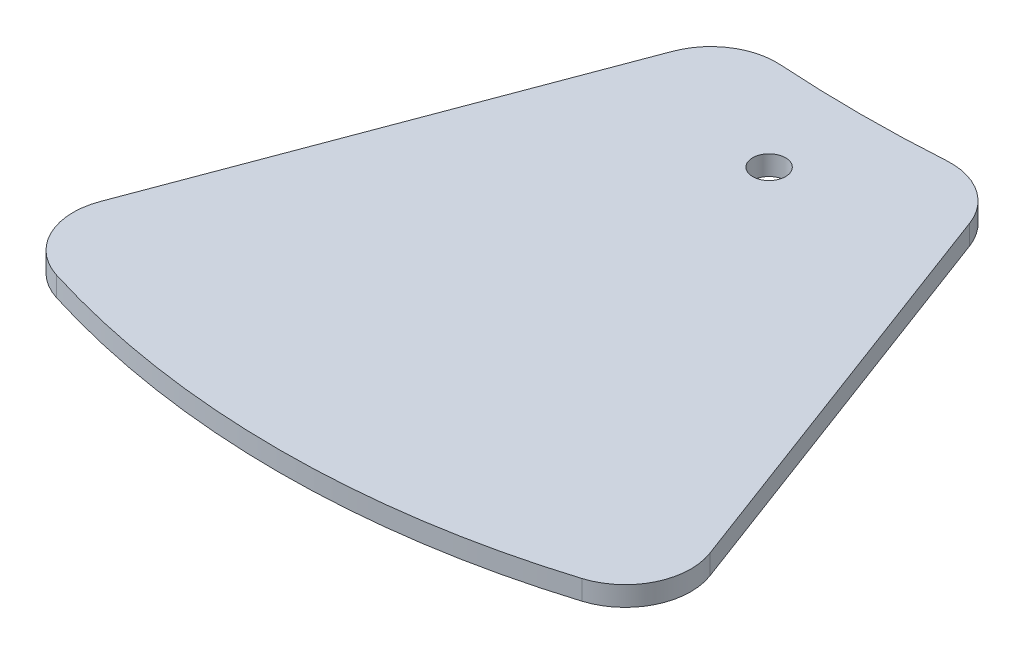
SolidWorks part; units mm, degrees
ref_plane "Front Plane" through (0, 0, 0) normal (0, 0, 1) x (1, 0, 0)
ref_plane "Top Plane" through (0, 0, 0) normal (0, 1, 0) x (1, 0, 0)
ref_plane "Right Plane" through (0, 0, 0) normal (1, 0, 0) x (0, 0, -1)
sketch "Sketch1" plane through (0, 0, 0) normal (0, 1, 0) x (1, 0, 0)
  line L0 (-20, 15) -> (-50, -65)
  line L1 (50, -65) -> (20, 15)
  line L2 (-20, 15) -> (20, 15) construction
  line L3 (50, -65) -> (-50, -65) construction
  arc A0 (-20, 15) -> (20, 15) centre (0, 207.5209) ccw
  arc A1 (-50, -65) -> (50, -65) centre (0, 60.3123) ccw
  circle A2 centre (0, 0) radius 2.5
  point P6 (0, 15)
  point P7 (0, -65)
  point P11 (0, 0)
  point P12 (0, 0)
  dimension "D3" = 100
  dimension "D1" = 5
  dimension "D2" = 40
  dimension "D4" = 15
  dimension "D5" = 80
extrude "Boss-Extrude1" add sketch "Sketch1" along normal blind 3
fillet "Fillet1" radius 10 4 edges at (20, 1.5, -15) (-20, 1.5, -15) (50, 1.5, 65) (-50, 1.5, 65)
